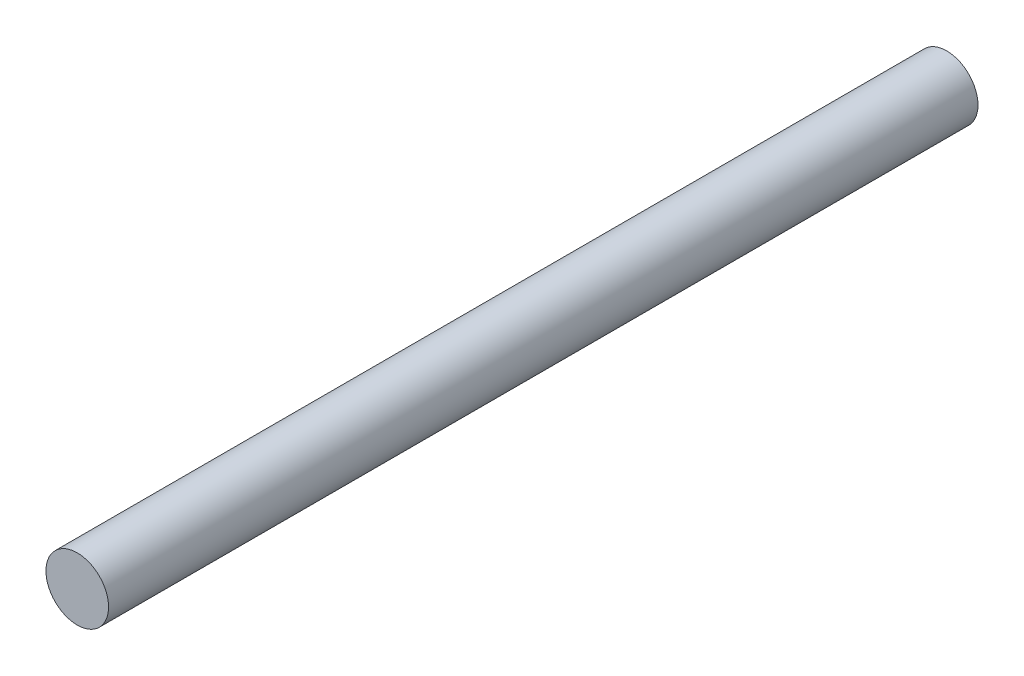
SolidWorks part; units mm, degrees
ref_plane "Plan de face" through (0, 0, 0) normal (0, 0, 1) x (1, 0, 0)
ref_plane "Plan de dessus" through (0, 0, 0) normal (0, 1, 0) x (1, 0, 0)
ref_plane "Plan de droite" through (0, 0, 0) normal (1, 0, 0) x (0, 0, -1)
sketch "Esquisse1" plane through (0, 0, 0) normal (0, 0, 1) x (1, 0, 0)
  circle A0 centre (0, 0) radius 9
  dimension "D1" = 18
extrude "Boss.-Extru.1" add sketch "Esquisse1" along normal blind 250
